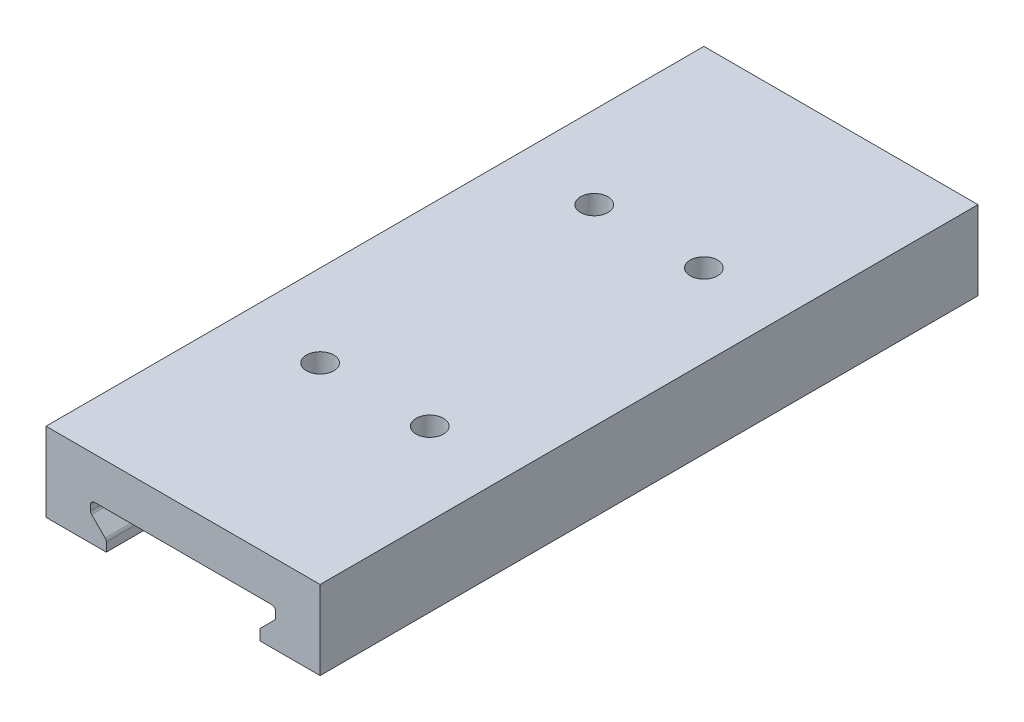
SolidWorks part; units mm, degrees
ref_plane "Front" through (0, 0, 0) normal (0, 0, 1) x (1, 0, 0)
ref_plane "bottom" through (0, 0, 0) normal (0, 1, 0) x (1, 0, 0)
ref_plane "Right" through (0, 0, 0) normal (1, 0, 0) x (0, 0, -1)
sketch "Sketch1" plane through (0, 0, 0) normal (0, 0, 1) x (1, 0, 0)
  line L1 (-12.5, 9) -> (12.5, 9)
  line L2 (-12.5, 9) -> (-12.5, 1.8)
  line L3 (-12.5, 1.8) -> (12.5, 1.8)
  line L4 (12.5, 9) -> (12.5, 1.8)
  point P4 (0, 1.8)
  dimension "D1" = 25
  dimension "D2" = 7.2
  dimension "D3" = 9
extrude "Extrude1" add sketch "Sketch1" along normal blind 60
sketch "Sketch2" plane through (0, 0, 0) normal (0, 0, -1) x (-1, 0, 0)
  line L0 (7, 5.2) -> (8.4342, 5.2)
  line L1 (0, 5.2) -> (7, 5.2)
  line L2 (0, 5.2) -> (0, 0.776)
  line L3 (0, 0.776) -> (7, 0.776)
  line L4 (7, 2.7658) -> (7, 0.776)
  line L5 (8.4342, 5.2) -> (8.4342, 4.2)
  line L6 (8.4342, 4.2) -> (7, 2.7658)
  dimension "D1" = 5.2
  dimension "D2" = 7
  dimension "D3" = 45
  dimension "D4" = 1
extrude "Cut-Extrude1" cut sketch "Sketch2" against normal through all
fillet "Fillet1" radius 0.35 3 edges at (-7, 2.7658, 30) (-8.4342, 4.2, 30) (-8.4342, 5.2, 30)
mirror "Mirror1" about plane through (0, 0, 0) normal (1, 0, 0) of "Cut-Extrude1", "Fillet1"
hole_wizard "M3x0.5 Tapped Hole1" positions "Sketch4" profile "Sketch3" tap size "M3x0.5" standard "Ansi Metric"
sketch "Sketch4" plane through (0, 9, 0) normal (0, 1, 0) x (-1, 0, 0)
  line L0 (-12.5, 0) -> (12.5, 0) construction
  line L1 (12.5, 60) -> (12.5, 0) construction
  point P0 (5, 17.5)
  dimension "D1" = 17.5
  dimension "D2" = 7.5
sketch "Sketch3" plane through (-5, 9, 17.5) normal (1, 0, 0) x (0, 0, 1)
  line L0 (0, 0) -> (0, 7.2)
  line L1 (0, 7.2) -> (1.25, 7.2)
  line L2 (1.25, 7.2) -> (1.25, 0)
  line L5 (1.25, 0) -> (0, 0)
  line L11 (0, -6.35) -> (0, 107.95) construction
  dimension "Thru Tap Drill Dia." = 2.5
  dimension "Thru Tap Drill Depth" = 7.2
ref_plane "center" through (0, 0, 30) normal (0, 0, 1) x (1, 0, 0)
mirror "Mirror2" about plane through (0, 0, 0) normal (1, 0, 0) of "M3x0.5 Tapped Hole1"
pattern_linear "LPattern2" count 2 spacing 25 along (0, 0, 1) of "Mirror2", "M3x0.5 Tapped Hole1"
sketch "Sketch5" plane through (0, 1.8, 0) normal (0, -1, 0) x (1, 0, 0)
  line L0 (-8.0842, 0) -> (8.0842, 0) construction
  line L1 (-4.6251, 18) -> (-15.353, 18)
  line L2 (-4.6251, 18) -> (-4.6251, 17.95)
  line L3 (-4.6251, 17.95) -> (-15.353, 17.95)
  line L4 (-15.353, 18) -> (-15.353, 17.95)
  dimension "D1" = 17.95
  dimension "D2" = 0.05
extrude "Cut-Extrude2" cut sketch "Sketch5" against normal blind 0.1
mirror "Mirror3" about plane through (0, 0, 30) normal (0, 0, 1) of "Cut-Extrude2"
ref_plane "Center2" through (0, 0, 0) normal (1, 0, 0) x (0, 0, -1)
